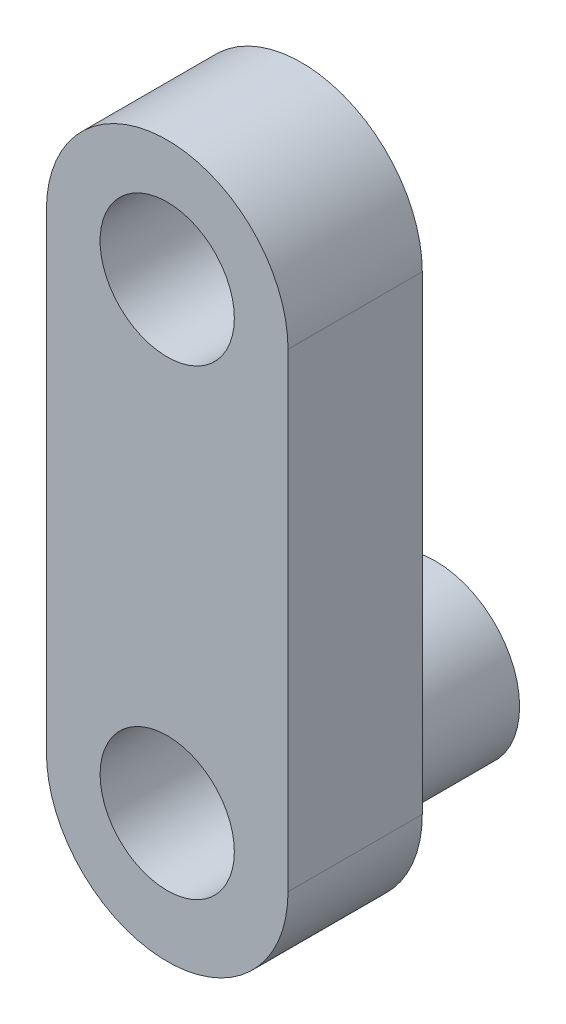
SolidWorks part; units mm, degrees
ref_plane "Спереди" through (0, 0, 0) normal (0, 0, 1) x (1, 0, 0)
ref_plane "Сверху" through (0, 0, 0) normal (0, 1, 0) x (1, 0, 0)
ref_plane "Справа" through (0, 0, 0) normal (1, 0, 0) x (0, 0, -1)
sketch "Эскиз1" plane through (0, 0, 0) normal (0, 0, 1) x (1, 0, 0)
  line L0 (0, 70) -> (0, 0) construction
  line L1 (18, 70) -> (18, 0)
  line L2 (-18, 70) -> (-18, 0)
  circle A0 centre (0, 1.1538) radius 10
  circle A1 centre (0, 70) radius 10
  arc A2 (18, 70) -> (-18, 70) centre (0, 70) ccw
  arc A3 (-18, 0) -> (18, 0) centre (0, 0) ccw
  point P4 (0, 35)
  dimension "D2" = 20
  dimension "D3" = 36
  dimension "D1" = 70
extrude "Бобышка-Вытянуть1" add sketch "Эскиз1" along normal mid plane 20
sketch "Эскиз3" plane through (0, 0, -10) normal (0, 0, -1) x (-1, 0, 0)
  circle A0 centre (0, 1.1538) radius 10 construction
  circle A1 centre (0, 1.1538) radius 10
  circle A2 centre (0, 1.1538) radius 12.5
  dimension "D1" = 25
extrude "Бобышка-Вытянуть2" add sketch "Эскиз3" along normal blind 20
